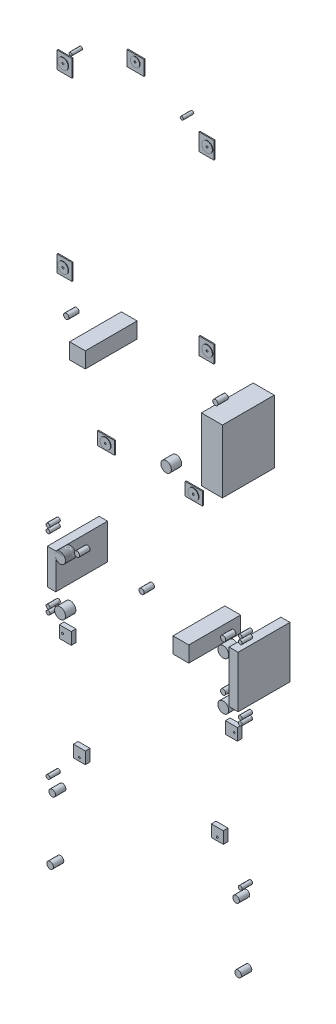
SolidWorks part; units mm, degrees
ref_plane "Plan de face" through (0, 0, 0) normal (0, 0, 1) x (1, 0, 0)
ref_plane "Plan de dessus" through (0, 0, 0) normal (0, 1, 0) x (1, 0, 0)
ref_plane "Plan de droite" through (0, 0, 0) normal (1, 0, 0) x (0, 0, -1)
sketch "Model" plane through (0, 0, 0) normal (0, 0, 1) x (1, 0, 0)
  line L777 (30831.1195, 65639.279) -> (30831.1195, 65637.8021)
  line L778 (30845.3932, 65637.8021) -> (30845.3932, 65639.279)
  line L927 (31638.0962, 65521.8123) -> (31644.4458, 65515.4628)
  line L928 (31638.0962, 65521.8123) -> (31638.0962, 65629.7546)
  line L929 (31796.8349, 65515.4628) -> (31803.1845, 65521.8123)
  line L930 (31796.8349, 65515.4628) -> (31644.4458, 65515.4628)
  line L931 (31803.1845, 65629.7546) -> (31803.1845, 65521.8123)
  line L932 (30954.8849, 65629.7546) -> (30954.8849, 65639.279)
  line L934 (30789.7966, 65521.8123) -> (30796.1461, 65515.4628)
  line L935 (30789.7966, 65521.8123) -> (30789.7966, 65629.7546)
  line L936 (30948.5353, 65515.4628) -> (30954.8849, 65521.8123)
  line L937 (30948.5353, 65515.4628) -> (30796.1461, 65515.4628)
  line L938 (30954.8849, 65629.7546) -> (30954.8849, 65521.8123)
  line L939 (31882.9602, 66848.3429) -> (31854.3872, 66848.3429)
  line L940 (31882.9602, 66830.3442) -> (31854.3872, 66830.3442)
  line L941 (30435.0092, 66830.3442) -> (30463.5822, 66830.3442)
  line L942 (30435.0092, 66848.3429) -> (30463.5822, 66848.3429)
  line L943 (30435.0092, 68535.1979) -> (30463.5822, 68535.1979)
  line L944 (30435.0092, 68553.1966) -> (30463.5822, 68553.1966)
  line L946 (31729.6397, 65547.2105) -> (31729.6397, 65575.7835)
  line L947 (31711.641, 65547.2105) -> (31711.641, 65575.7835)
  line L948 (30881.3401, 65547.2105) -> (30881.3401, 65575.7835)
  line L949 (30863.3414, 65547.2105) -> (30863.3414, 65575.7835)
  line L950 (31882.9602, 68553.1966) -> (31854.3872, 68553.1966)
  line L951 (31882.9602, 68535.1979) -> (31854.3872, 68535.1979)
  line L961 (30409.6111, 68626.7414) -> (30403.2615, 68620.3918)
  line L962 (30517.5534, 68461.6531) -> (30409.6111, 68461.6531)
  line L963 (30403.2615, 68468.0027) -> (30409.6111, 68461.6531)
  line L964 (30403.2615, 68468.0027) -> (30403.2615, 68620.3918)
  line L965 (30409.6111, 68626.7414) -> (30517.5534, 68626.7414)
  line L970 (30530.2525, 66763.149) -> (30530.2525, 66915.5381)
  line L975 (30409.6111, 66921.8877) -> (30403.2615, 66915.5381)
  line L976 (30517.5534, 66756.7994) -> (30409.6111, 66756.7994)
  line L977 (30403.2615, 66763.149) -> (30409.6111, 66756.7994)
  line L978 (30403.2615, 66763.149) -> (30403.2615, 66915.5381)
  line L979 (30409.6111, 66921.8877) -> (30517.5534, 66921.8877)
  line L984 (31787.717, 66915.5381) -> (31787.717, 66763.149)
  line L989 (31908.3584, 66756.7994) -> (31914.708, 66763.149)
  line L990 (31908.3584, 66756.7994) -> (31800.4161, 66756.7994)
  line L991 (31800.4161, 66921.8877) -> (31908.3584, 66921.8877)
  line L992 (31914.708, 66915.5381) -> (31908.3584, 66921.8877)
  line L993 (31914.708, 66915.5381) -> (31914.708, 66763.149)
  line L1003 (31908.3584, 68461.6531) -> (31914.708, 68468.0027)
  line L1004 (31908.3584, 68461.6531) -> (31800.4161, 68461.6531)
  line L1005 (31800.4161, 68626.7414) -> (31908.3584, 68626.7414)
  line L1006 (31914.708, 68620.3918) -> (31908.3584, 68626.7414)
  line L1007 (31914.708, 68620.3918) -> (31914.708, 68468.0027)
  line L4072 (30831.1644, 65636.7621) -> (30845.3483, 65636.7621)
  line L4073 (30831.1644, 65636.7621) -> (30831.1644, 65637.8021)
  line L4074 (30831.1195, 65637.8021) -> (30831.1644, 65637.8021)
  line L4075 (30845.3483, 65637.8021) -> (30845.3932, 65637.8021)
  line L4076 (30845.3483, 65637.8021) -> (30845.3483, 65636.7621)
  line L4077 (30831.9298, 65636.0022) -> (30844.5829, 65636.0022)
  line L4078 (30831.9298, 65636.0022) -> (30831.1644, 65636.7621)
  line L4079 (30845.3483, 65636.7621) -> (30844.5829, 65636.0022)
  line L4423 (30789.7964, 65629.7546) -> (30954.8848, 65629.7546)
  line L4424 (30954.8848, 65629.7546) -> (30954.8849, 65639.279)
  line L4431 (31149.9854, 68934.6945) -> (31149.9854, 68906.1215)
  line L4432 (31167.9841, 68934.6945) -> (31167.9841, 68906.1215)
  line L4435 (31241.5289, 68960.0927) -> (31241.5289, 68852.1503)
  line L4436 (31235.1793, 68966.4422) -> (31241.5289, 68960.0927)
  line L4437 (31082.7902, 68966.4422) -> (31235.1793, 68966.4422)
  line L4438 (31076.4406, 68960.0927) -> (31082.7902, 68966.4422)
  line L4439 (31076.4406, 68852.1503) -> (31076.4406, 68960.0927)
  line L4855 (30463.5822, 68507.6239) -> (30463.5822, 68580.7707)
  line L4856 (30500.1556, 68544.1973) -> (30427.0088, 68544.1973)
  line L4859 (31854.3872, 68507.6239) -> (31854.3872, 68580.7707)
  line L4860 (31890.9606, 68544.1973) -> (31817.8139, 68544.1973)
  line L4861 (31854.3872, 66802.7702) -> (31854.3872, 66875.917)
  line L4862 (31890.9606, 66839.3436) -> (31817.8139, 66839.3436)
  line L4863 (30463.5822, 66802.7702) -> (30463.5822, 66875.917)
  line L4864 (30500.1556, 66839.3436) -> (30427.0088, 66839.3436)
  line L4865 (30580.2615, 66497.9919) -> (30580.2615, 66571.1387)
  line L4866 (30616.8349, 66534.5653) -> (30543.6881, 66534.5653)
  line L4867 (31543.2594, 65723.347) -> (31543.2594, 65796.4938)
  line L4868 (31579.8328, 65759.9204) -> (31506.686, 65759.9204)
  line L4869 (30872.3407, 65539.2101) -> (30872.3407, 65612.3569)
  line L4870 (30908.9141, 65575.7835) -> (30835.7673, 65575.7835)
  line L4871 (31720.6404, 65539.2101) -> (31720.6404, 65612.3569)
  line L4872 (31757.2138, 65575.7835) -> (31684.067, 65575.7835)
  line L4873 (31158.9847, 68869.5481) -> (31158.9847, 68942.6949)
  line L4874 (31195.5581, 68906.1215) -> (31122.4113, 68906.1215)
  line L4977 (31606.1078, 65550.3875) -> (31606.1078, 65589.6753) construction
  arc A90 (31747.8447, 65602.5786) -> (31782.3297, 65602.5786) centre (31765.0872, 65663.6881) ccw
  circle A115 centre (31854.3872, 66839.3436) radius 50.7964
  arc A116 (31882.9602, 66830.3442) -> (31882.9602, 66848.3429) centre (31882.9602, 66839.3436) ccw
  arc A117 (31854.3872, 66848.3429) -> (31854.3872, 66830.3442) centre (31854.3872, 66839.3436) ccw
  circle A118 centre (30463.5822, 66839.3436) radius 50.7964
  arc A119 (30435.0092, 66848.3429) -> (30435.0092, 66830.3442) centre (30435.0092, 66839.3436) ccw
  arc A120 (30463.5822, 66830.3442) -> (30463.5822, 66848.3429) centre (30463.5822, 66839.3436) ccw
  circle A121 centre (30463.5822, 68544.1973) radius 50.7964
  arc A122 (30435.0092, 68553.1966) -> (30435.0092, 68535.1979) centre (30435.0092, 68544.1973) ccw
  arc A123 (30463.5822, 68535.1979) -> (30463.5822, 68553.1966) centre (30463.5822, 68544.1973) ccw
  arc A124 (31669.844, 65575.7835) -> (31765.1877, 65600.1927) centre (31720.6404, 65575.7835) ccw
  arc A126 (31721.7562, 65626.5676) -> (31669.844, 65575.7835) centre (31720.6404, 65575.7835) ccw
  arc A127 (31711.641, 65547.2105) -> (31729.6397, 65547.2105) centre (31720.6404, 65547.2105) ccw
  arc A128 (31729.6397, 65575.7835) -> (31711.641, 65575.7835) centre (31720.6404, 65575.7835) ccw
  circle A129 centre (30872.3407, 65575.7835) radius 50.7964
  arc A130 (30863.3414, 65547.2105) -> (30881.3401, 65547.2105) centre (30872.3407, 65547.2105) ccw
  arc A131 (30881.3401, 65575.7835) -> (30863.3414, 65575.7835) centre (30872.3407, 65575.7835) ccw
  circle A132 centre (31854.3872, 68544.1973) radius 50.7964
  arc A133 (31882.9602, 68535.1979) -> (31882.9602, 68553.1966) centre (31882.9602, 68544.1973) ccw
  arc A134 (31854.3872, 68553.1966) -> (31854.3872, 68535.1979) centre (31854.3872, 68544.1973) ccw
  circle A415 centre (32019.0691, 66534.5653) radius 25.3982
  circle A416 centre (30580.2615, 66534.5653) radius 25.3982
  circle A425 centre (31854.3872, 68544.1973) radius 6.917
  circle A426 centre (31854.3872, 66839.3436) radius 6.917
  circle A427 centre (30463.5822, 66839.3436) radius 6.917
  circle A428 centre (30463.5822, 68544.1973) radius 6.917
  circle A429 centre (31720.6404, 65575.7835) radius 6.917
  circle A430 centre (30872.3407, 65575.7835) radius 6.917
  circle A431 centre (31158.9847, 68906.1215) radius 44.1929
  arc A432 (31167.9841, 68934.6945) -> (31149.9854, 68934.6945) centre (31158.9847, 68934.6945) ccw
  arc A433 (31149.9854, 68906.1215) -> (31167.9841, 68906.1215) centre (31158.9847, 68906.1215) ccw
  circle A442 centre (31158.9847, 68906.1215) radius 6.917
  circle A443 centre (31543.2594, 65759.9204) radius 50.7964
  text T43 "G" font "ARIAL" height 38.0973
  text T50 "G" font "ROMAND" height 25.3982
  text T51 "G" font "ROMAND" height 25.3982
  text T52 "G" font "ROMAND" height 25.3982
  text T55 "G" font "ROMAND" height 25.3982
  text T56 "G" font "ROMAND" height 25.3982
sketch "Esquisse2" plane through (0, 0, 0) normal (0, 0, 1) x (1, 0, 0)
  line L6 (32176.7065, 63869.7909) -> (32061.7146, 63869.7909)
  line L7 (32176.7065, 63869.7909) -> (32176.7065, 63754.7991)
  line L8 (32176.7065, 63754.7991) -> (32061.7146, 63754.7991)
  line L9 (32061.7146, 63869.7909) -> (32061.7146, 63754.7991)
  line L10 (32041.0408, 62939.0366) -> (31926.049, 62939.0366)
  line L11 (32041.0408, 62939.0366) -> (32041.0408, 62824.9848)
  line L12 (32041.0408, 62824.9848) -> (31926.049, 62824.9848)
  line L13 (31926.049, 62939.0366) -> (31926.049, 62824.9848)
  line L14 (30709.8474, 62939.8358) -> (30594.8555, 62939.8358)
  line L15 (30709.8474, 62939.8358) -> (30709.8474, 62824.844)
  line L16 (30709.8474, 62824.844) -> (30594.8555, 62824.844)
  line L17 (30594.8555, 62939.8358) -> (30594.8555, 62824.844)
  line L18 (30459.1898, 63869.7909) -> (30574.1816, 63869.7909)
  line L19 (30459.1898, 63869.7909) -> (30459.1898, 63754.7991)
  line L20 (30459.1898, 63754.7991) -> (30574.1816, 63754.7991)
  line L21 (30574.1816, 63869.7909) -> (30574.1816, 63754.7991)
  circle A8 centre (32095.3712, 64025.2472) radius 52.5202
  circle A9 centre (32095.3712, 64488.5103) radius 52.5202
  circle A10 centre (30520.6832, 64487.9958) radius 52.5202
  circle A11 centre (30520.6832, 64025.1064) radius 52.5202
  circle A12 centre (32239.0447, 61870.558) radius 31.7477
  circle A13 centre (32219.0411, 62483.6144) radius 31.7477
  circle A14 centre (30444.9773, 62483.6144) radius 31.7477
  circle A15 centre (30424.9787, 61870.558) radius 31.7477
  circle A16 centre (30684.5431, 64599.6577) radius 25.3982
  circle A17 centre (31306.7988, 64599.6577) radius 25.3982
  circle A18 centre (32094.1428, 64599.6577) radius 25.3982
  circle A19 centre (32094.1428, 64152.6495) radius 25.3982
extrude "a-b-c" add sketch "Esquisse2" against normal blind 100
sketch "Esquisse3" plane through (0, 0, 0) normal (0, 0, 1) x (1, 0, 0)
  circle A10 centre (32259.4482, 64649.9603) radius 18.887
  circle A11 centre (32259.4482, 64699.9567) radius 18.887
  circle A12 centre (30404.5801, 64699.9567) radius 18.887
  circle A13 centre (30404.5802, 64649.9603) radius 18.887
  circle A14 centre (30404.5802, 64020.0051) radius 18.887
  circle A15 centre (30404.5802, 63970.0087) radius 18.887
  circle A16 centre (32259.4482, 64020.0051) radius 18.887
  circle A17 centre (32259.4482, 63970.0087) radius 18.887
  circle A18 centre (32259.4482, 62597.6063) radius 18.887
  circle A19 centre (30404.5802, 62597.6063) radius 18.887
extrude "d" add sketch "Esquisse3" against normal blind 100 separate body
sketch "Esquisse4" plane through (0, 0, 0) normal (0, 0, 1) x (1, 0, 0)
  circle A7 centre (30872.3407, 65575.7835) radius 50.7964
  circle A8 centre (31720.6404, 65575.7835) radius 50.7964
  circle A9 centre (31543.2594, 65759.9204) radius 50.7964
  circle A10 centre (30463.5822, 66839.3436) radius 50.7964
  circle A11 centre (31854.3872, 66839.3436) radius 50.7964
  circle A12 centre (30463.5822, 68544.1973) radius 50.7964
  circle A13 centre (31854.3872, 68544.1973) radius 50.7964
  circle A16 centre (32019.0691, 66534.5653) radius 25.3982
  circle A17 centre (30580.2615, 66534.5653) radius 25.3982
  circle A20 centre (31695.6485, 68747.3828) radius 15.2389
  circle A21 centre (30622.3209, 68747.3828) radius 15.2389
  circle A23 centre (31158.9847, 68906.1215) radius 44.1929
extrude "Boss.-Extru.3" add sketch "Esquisse4" against normal blind 100 separate body
sketch "Esquisse5" plane through (0, 0, 0) normal (0, 0, 1) x (1, 0, 0)
  line L1 (32151.7204, 64556.8176) -> (32238.8866, 64556.8176)
  line L2 (32151.7204, 64556.8176) -> (32151.7204, 64059.3316)
  line L3 (32151.7204, 64059.3316) -> (32238.8866, 64059.3316)
  line L4 (32238.8866, 64556.8176) -> (32238.8866, 64059.3316)
  line L5 (31762.7676, 64227.6279) -> (31610.3784, 64227.6279)
  line L6 (31762.7676, 64227.6279) -> (31762.7676, 64380.0173)
  line L7 (31762.7676, 64380.0173) -> (31610.3784, 64380.0173)
  line L8 (31610.3784, 64227.6279) -> (31610.3784, 64380.0173)
  line L9 (30398.0256, 64522.8486) -> (30479.4014, 64522.8486)
  line L10 (30398.0256, 64522.8486) -> (30398.0256, 64181.7838)
  line L11 (30398.0256, 64181.7838) -> (30479.4014, 64181.7838)
  line L12 (30479.4014, 64522.8486) -> (30479.4014, 64181.7838)
  line L13 (31884.4368, 66379.8355) -> (32087.6223, 66379.8355)
  line L14 (31884.4368, 66379.8355) -> (31884.4368, 65770.2789)
  line L15 (31884.4368, 65770.2789) -> (32087.6223, 65770.2789)
  line L16 (32087.6223, 66379.8355) -> (32087.6223, 65770.2789)
  line L17 (30612.6503, 66338.3373) -> (30764.4609, 66338.3373)
  line L18 (30612.6503, 66338.3373) -> (30612.6503, 66186.5267)
  line L19 (30612.6503, 66186.5267) -> (30764.4609, 66186.5267)
  line L20 (30764.4609, 66338.3373) -> (30764.4609, 66186.5267)
extrude "Boss.-Extru.4" add sketch "Esquisse5" against normal blind 500
sketch "Esquisse6" plane through (0, 0, 0) normal (0, 0, 1) x (1, 0, 0)
  line L1 (32284.4464, 61805.1627) -> (30379.582, 61805.1627)
  line L2 (32284.4464, 61805.1627) -> (32284.4464, 64724.955)
  line L3 (32284.4464, 64724.955) -> (30379.582, 64724.955)
  line L4 (30379.582, 61805.1627) -> (30379.582, 64724.955)
  line L5 (30546.1263, 68823.5774) -> (31771.8431, 68823.5774)
  line L6 (30546.1263, 68823.5774) -> (30546.1263, 66610.7598)
  line L7 (30546.1263, 66610.7598) -> (31771.8431, 66610.7598)
  line L8 (31771.8431, 68823.5774) -> (31771.8431, 66610.7598)
  line L9 (30483.3672, 65643.9776) -> (32139.7105, 65643.9776)
  line L10 (30483.3672, 65643.9776) -> (30483.3672, 66610.7498)
  line L11 (30483.3672, 66610.7498) -> (32139.7105, 66610.7498)
  line L12 (32139.7105, 65643.9776) -> (32139.7105, 66610.7498)
extrude "Boss.-Extru.5" add sketch "Esquisse6" along normal blind 2000 separate body
sketch "Esquisse7" plane through (0, 0, -100) normal (0, 0, -1) x (-1, 0, 0)
  line L1 (-30403.2615, 68468.0027) -> (-30403.2615, 68620.3918) construction
  line L2 (-30517.5534, 68461.6531) -> (-30409.6111, 68461.6531) construction
  line L3 (-30409.6111, 68626.7414) -> (-30517.5534, 68626.7414) construction
  line L4 (-30546.1263, 68461.6531) -> (-30546.1263, 68626.7414)
  line L5 (-30403.2615, 68461.6531) -> (-30403.2615, 68626.7414)
  line L6 (-30546.1263, 68461.6531) -> (-30403.2615, 68461.6531)
  line L7 (-30403.2615, 68626.7414) -> (-30546.1263, 68626.7414)
  line L8 (-31914.708, 68620.3918) -> (-31914.708, 68468.0027) construction
  line L9 (-31914.708, 68626.7414) -> (-31771.8431, 68626.7414)
  line L10 (-31914.708, 68626.7414) -> (-31914.708, 68461.6531)
  line L11 (-31914.708, 68461.6531) -> (-31771.8431, 68461.6531)
  line L12 (-31771.8431, 68626.7414) -> (-31771.8431, 68461.6531)
  line L13 (-31082.7902, 68966.4422) -> (-31235.1793, 68966.4422) construction
  line L14 (-31241.5289, 68823.5774) -> (-31076.4406, 68823.5774)
  line L15 (-31241.5289, 68823.5774) -> (-31241.5289, 68966.4422)
  line L16 (-31241.5289, 68966.4422) -> (-31076.4406, 68966.4422)
  line L17 (-31076.4406, 68823.5774) -> (-31076.4406, 68966.4422)
  line L18 (-31076.4406, 68852.1503) -> (-31076.4406, 68960.0927) construction
  line L19 (-31914.708, 66915.5381) -> (-31914.708, 66763.149) construction
  line L20 (-31914.708, 66921.8877) -> (-31771.8431, 66921.8877)
  line L21 (-31914.708, 66921.8877) -> (-31914.708, 66756.7994)
  line L22 (-31914.708, 66756.7994) -> (-31771.8431, 66756.7994)
  line L23 (-31771.8431, 66921.8877) -> (-31771.8431, 66756.7994)
  line L24 (-30409.6111, 66921.8877) -> (-30517.5534, 66921.8877) construction
  line L25 (-30546.1263, 66763.149) -> (-30403.2615, 66763.149)
  line L26 (-30546.1263, 66763.149) -> (-30546.1263, 66921.8877)
  line L27 (-30546.1263, 66921.8877) -> (-30403.2615, 66921.8877)
  line L28 (-30403.2615, 66763.149) -> (-30403.2615, 66921.8877)
  line L29 (-30403.2615, 66763.149) -> (-30403.2615, 66915.5381) construction
  line L30 (-31800.4161, 66921.8877) -> (-31908.3584, 66921.8877) construction
  line L31 (-31638.0962, 65521.8123) -> (-31638.0962, 65629.7546) construction
  line L32 (-31803.1845, 65639.279) -> (-31638.0962, 65639.279)
  line L33 (-31803.1845, 65639.279) -> (-31803.1845, 65515.4628)
  line L34 (-31803.1845, 65515.4628) -> (-31638.0962, 65515.4628)
  line L35 (-31638.0962, 65639.279) -> (-31638.0962, 65515.4628)
  line L36 (-30789.7966, 65521.8123) -> (-30789.7966, 65629.7546) construction
  line L37 (-30954.8849, 65639.279) -> (-30789.7966, 65639.279)
  line L38 (-30954.8849, 65639.279) -> (-30954.8849, 65515.4628)
  line L39 (-30954.8849, 65515.4628) -> (-30789.7966, 65515.4628)
  line L40 (-30789.7966, 65639.279) -> (-30789.7966, 65515.4628)
  line L41 (-31796.8349, 65515.4628) -> (-31644.4458, 65515.4628) construction
  circle A1 centre (-30463.5822, 68544.1973) radius 50.7964
  circle A3 centre (-31854.3872, 68544.1973) radius 50.7964
  circle A5 centre (-31158.9847, 68906.1215) radius 44.1929
  circle A8 centre (-30463.5822, 66839.3436) radius 50.7964
  circle A9 centre (-31854.3872, 66839.3436) radius 50.7964
  circle A11 centre (-31720.6404, 65575.7835) radius 50.7964
  circle A13 centre (-30872.3407, 65575.7835) radius 50.7964
extrude "Boss.-Extru.6" add sketch "Esquisse7" against normal blind 10 separate body
sketch "Esquisse8" plane through (0, 0, 0) normal (0, 0, 1) x (1, 0, 0)
  circle A0 centre (30463.5822, 68544.1973) radius 50.7964 construction
  circle A1 centre (31854.3872, 68544.1973) radius 50.7964
  circle A2 centre (31854.3872, 68544.1973) radius 50.7964
  circle A3 centre (31158.9847, 68906.1215) radius 44.1929 construction
  circle A4 centre (30463.5822, 68544.1973) radius 50.7964
  circle A5 centre (31158.9847, 68906.1215) radius 44.1929
  circle A6 centre (30872.3407, 65575.7835) radius 50.7964 construction
  circle A7 centre (31720.6404, 65575.7835) radius 50.7964 construction
  circle A8 centre (31854.3872, 66839.3436) radius 50.7964 construction
  circle A9 centre (30463.5822, 66839.3436) radius 50.7964 construction
  circle A10 centre (30872.3407, 65575.7835) radius 50.7964
  circle A11 centre (31720.6404, 65575.7835) radius 50.7964
  circle A12 centre (31854.3872, 66839.3436) radius 50.7964
  circle A13 centre (30463.5822, 66839.3436) radius 50.7964
  dimension "D1" = 0
extrude "Enlèv. mat.-Extru.1" cut sketch "Esquisse8" against normal blind 85
hole_wizard "Dégagement M161" positions "Esquisse9" profile "Esquisse10" hole size "M16" standard "ISO"
sketch "Esquisse9" plane through (0, 0, -85) normal (0, 0, 1) x (1, 0, 0)
  point P0 (30872.3407, 65575.7835)
  point P3 (31720.6404, 65575.7835)
  point P6 (30463.5822, 66839.3436)
  point P9 (31854.3872, 66839.3436)
  point P12 (31854.3872, 68544.1973)
  point P15 (31158.9847, 68906.1215)
  point P18 (30463.5822, 68544.1973)
sketch "Esquisse10" plane through (30872.3407, 65575.7835, -85) normal (1, 0, 0) x (0, -1, 0)
  line L0 (0, 0) -> (0, 38.1577)
  line L1 (0, 38.1577) -> (9, 32.75)
  line L2 (9, 32.75) -> (9, 0)
  line L5 (9, 0) -> (0, 0)
  line L10 (0, 38.1577) -> (-9, 32.75) construction
  line L11 (0, -6.35) -> (0, 107.95) construction
  dimension "Diamètre du perçage" = 18
  dimension "Profondeur du perçage" = 32.75
  dimension "Angle de pointe" = 118
sketch "Esquisse11" plane through (30379.582, 0, 0) normal (-1, 0, 0) x (0, 0, 1)
  line L0 (0, 64724.955) -> (0, 61805.1627) construction
  line L1 (0, 63911.7019) -> (-54.709, 63911.7019)
  line L2 (0, 63911.7019) -> (0, 62771.521)
  line L3 (0, 62771.521) -> (-54.709, 62771.521)
  line L4 (-54.709, 63911.7019) -> (-54.709, 62771.521)
extrude "Enlèv. mat.-Extru.2" cut sketch "Esquisse11" against normal through all
hole_wizard "Dégagement M162" positions "Esquisse12" profile "Esquisse13" hole size "M16" standard "ISO"
sketch "Esquisse12" plane through (0, 0, -54.709) normal (0, 0, 1) x (1, 0, 0)
  point P0 (32146.3311, 63812.4331)
  point P3 (30489.6923, 63812.4331)
  point P6 (30652.2523, 62855.4119)
  point P9 (31983.7711, 62855.4119)
sketch "Esquisse13" plane through (32146.3311, 63812.4331, -54.709) normal (1, 0, 0) x (0, -1, 0)
  line L0 (0, 0) -> (0, 445.291)
  line L1 (0, 445.291) -> (9, 445.291)
  line L2 (9, 445.291) -> (9, 0)
  line L5 (9, 0) -> (0, 0)
  line L11 (0, -6.35) -> (0, 107.95) construction
  dimension "Diamètre du perçage jusqu'au prochain" = 18
  dimension "Profondeur du perçage jusqu'au prochain" = 445.291
sketch "Esquisse14" plane through (0, 0, 0) normal (0, 0, -1) x (-1, 0, 0)
  circle A0 centre (-30520.6832, 64487.9958) radius 52.5202 construction
  circle A1 centre (-30520.6832, 64487.9958) radius 52.5202
extrude "Boss.-Extru.7" add sketch "Esquisse14" along normal up to surface (100 mm away) separate body
delete or keep bodies "Corps-Supprimer/Garder 1" type delete bodies bodies 145 144 146
